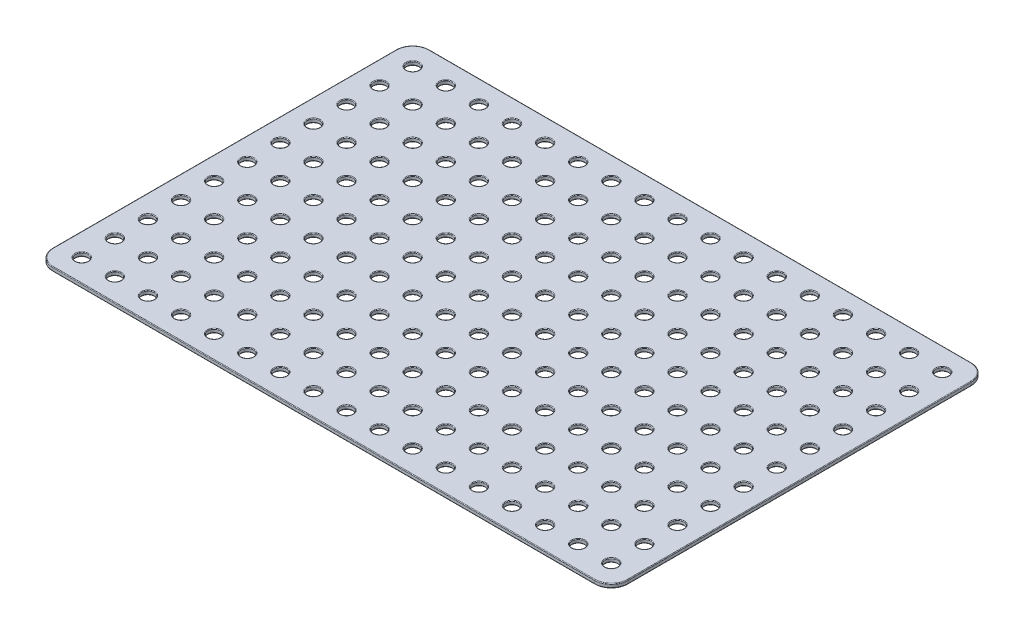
SolidWorks part; units mm, degrees
ref_plane "Front" through (0, 0, 0) normal (0, 0, 1) x (1, 0, 0)
ref_plane "Top" through (0, 0, 0) normal (0, 1, 0) x (1, 0, 0)
ref_plane "Right" through (0, 0, 0) normal (1, 0, 0) x (0, 0, -1)
sketch "Sketch1" plane through (0, 0, 0) normal (0, 1, 0) x (1, 0, 0)
  line L1 (6.35, 0) -> (214.3252, 0)
  line L2 (0, 6.35) -> (0, 138.1252)
  line L3 (6.35, 144.4752) -> (214.3252, 144.4752)
  line L4 (220.6752, 6.35) -> (220.6752, 138.1252)
  arc A0 (0, 138.1252) -> (6.35, 144.4752) centre (6.35, 138.1252) cw
  arc A1 (6.35, 0) -> (0, 6.35) centre (6.35, 6.35) cw
  arc A2 (214.3252, 0) -> (220.6752, 6.35) centre (214.3252, 6.35) ccw
  arc A3 (214.3252, 144.4752) -> (220.6752, 138.1252) centre (214.3252, 138.1252) cw
  point P6 (0, 144.4752)
  point P9 (0, 0)
  point P14 (220.6752, 144.4752)
  dimension "D3" = 6.35
  dimension "D1" = 220.6752
  dimension "D2" = 144.4752
extrude "Extrude1" add sketch "Sketch1" along normal blind 1.524
sketch "Sketch2" plane through (0, 1.524, 0) normal (0, 1, 0) x (-1, 0, 0)
  line L0 (0, -138.1252) -> (0, -6.35) construction
  line L1 (-6.35, 0) -> (-214.3252, 0) construction
  circle A0 centre (-8.7376, -8.7376) radius 2.413
  dimension "D1" = 4.826
  dimension "D2" = 8.7376
  dimension "D3" = 8.7376
extrude "Cut-Extrude1" cut sketch "Sketch2" against normal through all
pattern_linear "LPattern1" count 17 spacing 12.7 along (1, 0, 0) count 11 spacing 12.7 along (0, 0, -1) of "Cut-Extrude1"
fillet "Fillet1" radius 0.254 390 edges at (199.2376, 0, -120.6246) (186.5376, 0, -120.6246) (173.8376, 0, -120.6246) (161.1376, 0, -120.6246) (148.4376, 0, -120.6246) (135.7376, 0, -120.6246) (123.0376, 0, -120.6246) (110.3376, 0, -120.6246) (97.6376, 0, -120.6246) (84.9376, 0, -120.6246) (72.2376, 0, -120.6246) (59.5376, 0, -120.6246) (46.8376, 0, -120.6246) (34.1376, 0, -120.6246) (21.4376, 0, -120.6246) (199.2376, 0, -107.9246) (186.5376, 0, -107.9246) (173.8376, 0, -107.9246) (161.1376, 0, -107.9246) (148.4376, 0, -107.9246) (135.7376, 0, -107.9246) (123.0376, 0, -107.9246) (110.3376, 0, -107.9246) (97.6376, 0, -107.9246) (84.9376, 0, -107.9246) (72.2376, 0, -107.9246) (59.5376, 0, -107.9246) (46.8376, 0, -107.9246) (34.1376, 0, -107.9246) (21.4376, 0, -107.9246) (199.2376, 0, -95.2246) (186.5376, 0, -95.2246) (173.8376, 0, -95.2246) (161.1376, 0, -95.2246) (148.4376, 0, -95.2246) (135.7376, 0, -95.2246) (123.0376, 0, -95.2246) (110.3376, 0, -95.2246) (97.6376, 0, -95.2246) (84.9376, 0, -95.2246) (72.2376, 0, -95.2246) (59.5376, 0, -95.2246) (46.8376, 0, -95.2246) (34.1376, 0, -95.2246) (21.4376, 0, -95.2246) (199.2376, 0, -82.5246) (186.5376, 0, -82.5246) (173.8376, 0, -82.5246) (161.1376, 0, -82.5246) (148.4376, 0, -82.5246) (135.7376, 0, -82.5246) (123.0376, 0, -82.5246) (110.3376, 0, -82.5246) (97.6376, 0, -82.5246) (84.9376, 0, -82.5246) (72.2376, 0, -82.5246) (59.5376, 0, -82.5246) (46.8376, 0, -82.5246) (34.1376, 0, -82.5246) (21.4376, 0, -82.5246) (199.2376, 0, -69.8246) (186.5376, 0, -69.8246) (173.8376, 0, -69.8246) (161.1376, 0, -69.8246) (148.4376, 0, -69.8246) (135.7376, 0, -69.8246) (123.0376, 0, -69.8246) (110.3376, 0, -69.8246) (97.6376, 0, -69.8246) (84.9376, 0, -69.8246) (72.2376, 0, -69.8246) (59.5376, 0, -69.8246) (46.8376, 0, -69.8246) (34.1376, 0, -69.8246) (21.4376, 0, -69.8246) (199.2376, 0, -57.1246) (186.5376, 0, -57.1246) (173.8376, 0, -57.1246) (161.1376, 0, -57.1246) (148.4376, 0, -57.1246) (135.7376, 0, -57.1246) (123.0376, 0, -57.1246) (110.3376, 0, -57.1246) (97.6376, 0, -57.1246) (84.9376, 0, -57.1246) (72.2376, 0, -57.1246) (59.5376, 0, -57.1246) (46.8376, 0, -57.1246) (34.1376, 0, -57.1246) (21.4376, 0, -57.1246) (199.2376, 0, -44.4246) (186.5376, 0, -44.4246) (173.8376, 0, -44.4246) (161.1376, 0, -44.4246) (148.4376, 0, -44.4246) (135.7376, 0, -44.4246) (123.0376, 0, -44.4246) (110.3376, 0, -44.4246) (97.6376, 0, -44.4246) (84.9376, 0, -44.4246) (72.2376, 0, -44.4246) (59.5376, 0, -44.4246) (46.8376, 0, -44.4246) (34.1376, 0, -44.4246) (21.4376, 0, -44.4246) (199.2376, 0, -31.7246) (186.5376, 0, -31.7246) (173.8376, 0, -31.7246) (161.1376, 0, -31.7246) (148.4376, 0, -31.7246) (135.7376, 0, -31.7246) (123.0376, 0, -31.7246) (110.3376, 0, -31.7246) (97.6376, 0, -31.7246) (84.9376, 0, -31.7246) (72.2376, 0, -31.7246) (59.5376, 0, -31.7246) (46.8376, 0, -31.7246) (34.1376, 0, -31.7246) (21.4376, 0, -31.7246) (199.2376, 0, -19.0246) (186.5376, 0, -19.0246) (173.8376, 0, -19.0246) (161.1376, 0, -19.0246) (148.4376, 0, -19.0246) (135.7376, 0, -19.0246) (123.0376, 0, -19.0246) (110.3376, 0, -19.0246) (97.6376, 0, -19.0246) (84.9376, 0, -19.0246) (72.2376, 0, -19.0246) (59.5376, 0, -19.0246) (46.8376, 0, -19.0246) (34.1376, 0, -19.0246) (0, 0, -72.2376) (1.8599, 0, -1.8599) (110.3376, 0, 0) (218.8153, 0, -1.8599) (220.6752, 0, -72.2376) (218.8153, 0, -142.6153) (110.3376, 0, -144.4752) (1.8599, 0, -142.6153) (8.7376, 0, -6.3246) (21.4376, 0, -19.0246) (8.7376, 0, -19.0246) (8.7376, 0, -31.7246) (8.7376, 0, -44.4246) (8.7376, 0, -57.1246) (8.7376, 0, -69.8246) (8.7376, 0, -82.5246) (8.7376, 0, -95.2246) (8.7376, 0, -107.9246) (8.7376, 0, -120.6246) (8.7376, 0, -133.3246) (21.4376, 0, -6.3246) (21.4376, 0, -133.3246) (34.1376, 0, -6.3246) (34.1376, 0, -133.3246) (46.8376, 0, -6.3246) (46.8376, 0, -133.3246) (59.5376, 0, -6.3246) (59.5376, 0, -133.3246) (72.2376, 0, -6.3246) (72.2376, 0, -133.3246) (84.9376, 0, -6.3246) (84.9376, 0, -133.3246) (97.6376, 0, -6.3246) (97.6376, 0, -133.3246) (110.3376, 0, -6.3246) (110.3376, 0, -133.3246) (123.0376, 0, -6.3246) (123.0376, 0, -133.3246) (135.7376, 0, -6.3246) (135.7376, 0, -133.3246) (148.4376, 0, -6.3246) (148.4376, 0, -133.3246) (161.1376, 0, -6.3246) (161.1376, 0, -133.3246) (173.8376, 0, -6.3246) (173.8376, 0, -133.3246) (186.5376, 0, -6.3246) (186.5376, 0, -133.3246) (199.2376, 0, -6.3246) (199.2376, 0, -133.3246) (211.9376, 0, -6.3246) (211.9376, 0, -19.0246) (211.9376, 0, -31.7246) (211.9376, 0, -44.4246) (211.9376, 0, -57.1246) (211.9376, 0, -69.8246) (211.9376, 0, -82.5246) (211.9376, 0, -95.2246) (211.9376, 0, -107.9246) (211.9376, 0, -120.6246) (211.9376, 0, -133.3246) (199.2376, 1.524, -120.6246) (186.5376, 1.524, -120.6246) (173.8376, 1.524, -120.6246) (161.1376, 1.524, -120.6246) (148.4376, 1.524, -120.6246) (135.7376, 1.524, -120.6246) (123.0376, 1.524, -120.6246) (110.3376, 1.524, -120.6246) (97.6376, 1.524, -120.6246) (84.9376, 1.524, -120.6246) (72.2376, 1.524, -120.6246) (59.5376, 1.524, -120.6246) (46.8376, 1.524, -120.6246) (34.1376, 1.524, -120.6246) (21.4376, 1.524, -120.6246) (199.2376, 1.524, -107.9246) (186.5376, 1.524, -107.9246) (173.8376, 1.524, -107.9246) (161.1376, 1.524, -107.9246) (148.4376, 1.524, -107.9246) (135.7376, 1.524, -107.9246) (123.0376, 1.524, -107.9246) (110.3376, 1.524, -107.9246) (97.6376, 1.524, -107.9246) (84.9376, 1.524, -107.9246) (72.2376, 1.524, -107.9246) (59.5376, 1.524, -107.9246) (46.8376, 1.524, -107.9246) (34.1376, 1.524, -107.9246) (21.4376, 1.524, -107.9246) (199.2376, 1.524, -95.2246) (186.5376, 1.524, -95.2246) (173.8376, 1.524, -95.2246) (161.1376, 1.524, -95.2246) (148.4376, 1.524, -95.2246) (135.7376, 1.524, -95.2246) (123.0376, 1.524, -95.2246) (110.3376, 1.524, -95.2246) (97.6376, 1.524, -95.2246) (84.9376, 1.524, -95.2246) (72.2376, 1.524, -95.2246) (59.5376, 1.524, -95.2246) (46.8376, 1.524, -95.2246) (34.1376, 1.524, -95.2246) (21.4376, 1.524, -95.2246) (199.2376, 1.524, -82.5246) (186.5376, 1.524, -82.5246) (173.8376, 1.524, -82.5246) (161.1376, 1.524, -82.5246) (148.4376, 1.524, -82.5246) (135.7376, 1.524, -82.5246) (123.0376, 1.524, -82.5246) (110.3376, 1.524, -82.5246) (97.6376, 1.524, -82.5246) (84.9376, 1.524, -82.5246) (72.2376, 1.524, -82.5246) (59.5376, 1.524, -82.5246) (46.8376, 1.524, -82.5246) (34.1376, 1.524, -82.5246) (21.4376, 1.524, -82.5246) (199.2376, 1.524, -69.8246) (186.5376, 1.524, -69.8246) (173.8376, 1.524, -69.8246) (161.1376, 1.524, -69.8246) (148.4376, 1.524, -69.8246) (135.7376, 1.524, -69.8246) (123.0376, 1.524, -69.8246) (110.3376, 1.524, -69.8246) (97.6376, 1.524, -69.8246) (84.9376, 1.524, -69.8246) (72.2376, 1.524, -69.8246) (59.5376, 1.524, -69.8246) (46.8376, 1.524, -69.8246) (34.1376, 1.524, -69.8246) (21.4376, 1.524, -69.8246) (199.2376, 1.524, -57.1246) (186.5376, 1.524, -57.1246) (173.8376, 1.524, -57.1246) (161.1376, 1.524, -57.1246) (148.4376, 1.524, -57.1246) (135.7376, 1.524, -57.1246) (123.0376, 1.524, -57.1246) (110.3376, 1.524, -57.1246) (97.6376, 1.524, -57.1246) (84.9376, 1.524, -57.1246) (72.2376, 1.524, -57.1246) (59.5376, 1.524, -57.1246) (46.8376, 1.524, -57.1246) (34.1376, 1.524, -57.1246) (21.4376, 1.524, -57.1246) (199.2376, 1.524, -44.4246) (186.5376, 1.524, -44.4246) (173.8376, 1.524, -44.4246) (161.1376, 1.524, -44.4246) (148.4376, 1.524, -44.4246) (135.7376, 1.524, -44.4246) (123.0376, 1.524, -44.4246) (110.3376, 1.524, -44.4246) (97.6376, 1.524, -44.4246) (84.9376, 1.524, -44.4246) (72.2376, 1.524, -44.4246) (59.5376, 1.524, -44.4246) (46.8376, 1.524, -44.4246) (34.1376, 1.524, -44.4246) (21.4376, 1.524, -44.4246) (199.2376, 1.524, -31.7246) (186.5376, 1.524, -31.7246) (173.8376, 1.524, -31.7246) (161.1376, 1.524, -31.7246) (148.4376, 1.524, -31.7246) (135.7376, 1.524, -31.7246) (123.0376, 1.524, -31.7246) (110.3376, 1.524, -31.7246) (97.6376, 1.524, -31.7246) (84.9376, 1.524, -31.7246) (72.2376, 1.524, -31.7246) (59.5376, 1.524, -31.7246) (46.8376, 1.524, -31.7246) (34.1376, 1.524, -31.7246) (21.4376, 1.524, -31.7246) (199.2376, 1.524, -19.0246) (186.5376, 1.524, -19.0246) (173.8376, 1.524, -19.0246) (161.1376, 1.524, -19.0246) (148.4376, 1.524, -19.0246) (135.7376, 1.524, -19.0246) (123.0376, 1.524, -19.0246) (110.3376, 1.524, -19.0246) (97.6376, 1.524, -19.0246) (84.9376, 1.524, -19.0246) (72.2376, 1.524, -19.0246) (59.5376, 1.524, -19.0246) (46.8376, 1.524, -19.0246) (34.1376, 1.524, -19.0246) (110.3376, 1.524, -144.4752) (218.8153, 1.524, -142.6153) (220.6752, 1.524, -72.2376) (218.8153, 1.524, -1.8599) (110.3376, 1.524, 0) (1.8599, 1.524, -1.8599) (0, 1.524, -72.2376) (1.8599, 1.524, -142.6153) (8.7376, 1.524, -6.3246) (21.4376, 1.524, -19.0246) (8.7376, 1.524, -19.0246) (8.7376, 1.524, -31.7246) (8.7376, 1.524, -44.4246) (8.7376, 1.524, -57.1246) (8.7376, 1.524, -69.8246) (8.7376, 1.524, -82.5246) (8.7376, 1.524, -95.2246) (8.7376, 1.524, -107.9246) (8.7376, 1.524, -120.6246) (8.7376, 1.524, -133.3246) (21.4376, 1.524, -6.3246) (21.4376, 1.524, -133.3246) (34.1376, 1.524, -6.3246) (34.1376, 1.524, -133.3246) (46.8376, 1.524, -6.3246) (46.8376, 1.524, -133.3246) (59.5376, 1.524, -6.3246) (59.5376, 1.524, -133.3246) (72.2376, 1.524, -6.3246) (72.2376, 1.524, -133.3246) (84.9376, 1.524, -6.3246) (84.9376, 1.524, -133.3246) (97.6376, 1.524, -6.3246) (97.6376, 1.524, -133.3246) (110.3376, 1.524, -6.3246) (110.3376, 1.524, -133.3246) (123.0376, 1.524, -6.3246) (123.0376, 1.524, -133.3246) (135.7376, 1.524, -6.3246) (135.7376, 1.524, -133.3246) (148.4376, 1.524, -6.3246) (148.4376, 1.524, -133.3246) (161.1376, 1.524, -6.3246) (161.1376, 1.524, -133.3246) (173.8376, 1.524, -6.3246) (173.8376, 1.524, -133.3246) (186.5376, 1.524, -6.3246) (186.5376, 1.524, -133.3246) (199.2376, 1.524, -6.3246) (199.2376, 1.524, -133.3246) (211.9376, 1.524, -6.3246) (211.9376, 1.524, -19.0246) (211.9376, 1.524, -31.7246) (211.9376, 1.524, -44.4246) (211.9376, 1.524, -57.1246) (211.9376, 1.524, -69.8246) (211.9376, 1.524, -82.5246) (211.9376, 1.524, -95.2246) (211.9376, 1.524, -107.9246) (211.9376, 1.524, -120.6246) (211.9376, 1.524, -133.3246)
